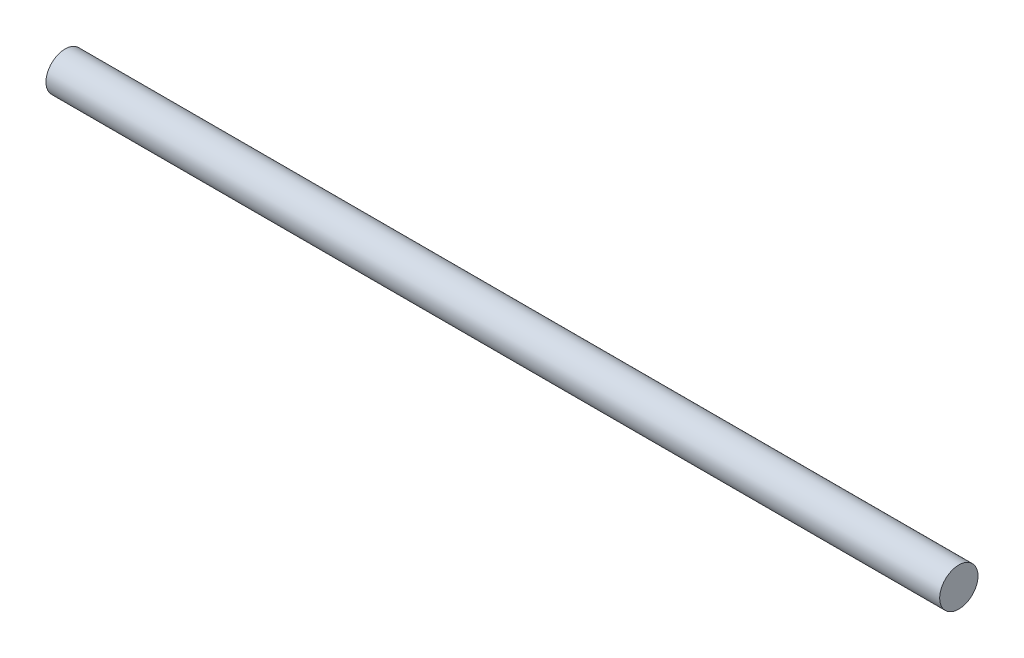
SolidWorks part; units mm, degrees
ref_plane "Front Plane" through (0, 0, 0) normal (0, 0, 1) x (1, 0, 0)
ref_plane "Top Plane" through (0, 0, 0) normal (0, 1, 0) x (1, 0, 0)
ref_plane "Right Plane" through (0, 0, 0) normal (1, 0, 0) x (0, 0, -1)
sketch "Sketch1" plane through (0, 0, 0) normal (1, 0, 0) x (0, 0, -1)
  circle A0 centre (0, 0) radius 3
  dimension "D1" = 6
extrude "Boss-Extrude1" add sketch "Sketch1" along normal blind 140
